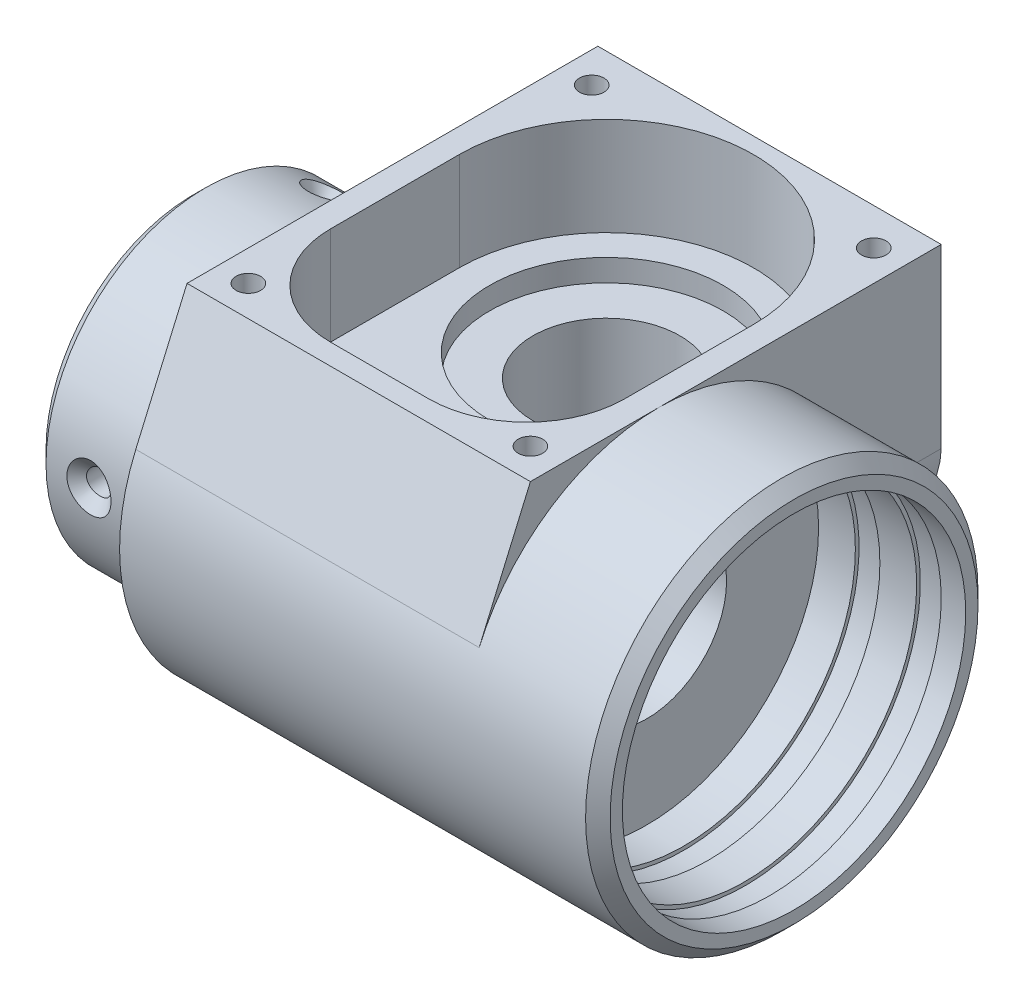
SolidWorks part; units mm, degrees
ref_plane "Plane1" through (0, 0, 0) normal (0, 0, 1) x (1, 0, 0)
ref_plane "Plane2" through (0, 0, 0) normal (0, 1, 0) x (1, 0, 0)
ref_plane "Plane3" through (0, 0, 0) normal (1, 0, 0) x (0, 0, -1)
sketch "Esquisse1" plane through (0, 0, 0) normal (0, 0, 1) x (1, 0, 0)
  line L0 (-37.8631, 0) -> (43.2337, 0) construction
  line L1 (-24, 0) -> (-24, 13)
  line L2 (-24, 13) -> (-14, 13)
  line L3 (-14, 13) -> (-14, 16)
  line L4 (-14, 16) -> (25, 16)
  line L5 (25, 16) -> (25, 0)
  line L6 (0, 0) -> (0, 32.7609) construction
  line L7 (25, 0) -> (-24, 0)
  dimension "D1" = 16
  dimension "D2" = 13
  dimension "D3" = 25
  dimension "D4" = 10
  dimension "D5" = 14
revolve "Base-Révolution" add sketch "Esquisse1" angle 360 about L0
chamfer "Chanfrein1" distance 1 angle 45
ref_plane "Plan4" through (0, 16, 0) normal (0, 1, 0) x (-1, 0, 0)
sketch "Esquisse2" plane through (0, 16, 0) normal (0, 1, 0) x (-1, 0, 0)
  line L0 (0, -19.7574) -> (0, 34.8803) construction
  line L1 (32.6576, 0) -> (-50.3214, 0) construction
  line L2 (-14, -23) -> (14, -23)
  line L3 (14, -23) -> (14, 10.5)
  line L4 (14, 10.5) -> (-14, 10.5)
  line L5 (-14, -23) -> (-14, 10.5)
  point P11 (0, -23)
  point P12 (0, 10.5)
  dimension "D1" = 14
  dimension "D2" = 23
  dimension "D3" = 10.5
extrude "Boss.-Extru.2" add sketch "Esquisse2" against normal blind 16
sketch "Esquisse3" plane through (14, 0, 0) normal (1, 0, 0) x (0, 0, -1)
  line L0 (-10.5, 16) -> (-14.6785, 6.3672)
  line L1 (-10.5, 16) -> (-10.5, 12.0727)
  arc A0 (0, 16) -> (-10.5, 12.0727) centre (0, 0) ccw construction
  arc A1 (-10.5, 12.0727) -> (-14.6785, 6.3672) centre (0, 0) ccw
extrude "Boss.-Extru.3" add sketch "Esquisse3" along normal up to surface (28 mm away)
ref_plane "Plan5" through (0, 0, -23) normal (0, 0, 1) x (1, 0, 0)
sketch "Esquisse7" plane through (0, 0, -23) normal (0, 0, 1) x (1, 0, 0)
  line L0 (0, 28.1619) -> (0, -32.0522) construction
  line L1 (14, 16) -> (-14, 16)
  line L2 (-14, 16) -> (-14, 0)
  line L3 (-14, 0) -> (-8.8013, -16)
  line L4 (-8.8013, -16) -> (8.8013, -16)
  line L5 (-14, 0) -> (-14, -17.7602) construction
  line L6 (14, 0) -> (8.8013, -16)
  line L7 (14, 16) -> (14, 0)
  point P13 (0, -16)
  point P15 (0, 16)
  dimension "D1" = 18
  dimension "D2" = 32
extrude "Boss.-Extru.5" add sketch "Esquisse7" along normal blind 23
sketch "Esquisse8" plane through (14, 0, 0) normal (1, 0, 0) x (0, 0, -1)
  line L0 (36.9905, 38.4387) -> (13.8182, -25.2269)
  line L1 (0, 0) -> (0, -26.9625) construction
  line L2 (13.8182, -25.2269) -> (43.0589, -25.2269)
  line L3 (36.9905, 38.4387) -> (59.2712, 38.4387)
  line L4 (59.2712, 38.4387) -> (43.0589, -25.2269)
  line L6 (9.5707, 16) -> (21.9836, 16) construction
  line L7 (23, 16) -> (0, 16) construction
  dimension "D1" = 20
extrude "Enlèv. mat.-Extru.2" cut sketch "Esquisse8" against normal through all
fillet "Congé1" radius 10
fillet "Congé2" radius 2
fillet "Congé4" radius 10
sketch "Esquisse9" plane through (0, 16, 0) normal (0, 1, 0) x (-1, 0, 0)
  line L0 (0, -25.3995) -> (0, 11.9181) construction
  line L1 (11.999, 0) -> (-10.981, 0) construction
  line L2 (37.8631, 0) -> (-43.2337, 0) construction
  line L3 (17.266, -9.7) -> (-15.3853, -9.7) construction
  line L4 (-12, -9.7) -> (-12, 0.8)
  line L5 (-4, 8.8) -> (4, 8.8)
  line L6 (12, -9.7) -> (12, 0.8)
  arc A0 (4, 8.8) -> (12, 0.8) centre (4, 0.8) cw
  arc A1 (-12, -9.7) -> (12, -9.7) centre (0, -9.7) ccw
  arc A2 (-4, 8.8) -> (-12, 0.8) centre (-4, 0.8) ccw
  point P19 (0, 8.8)
  dimension "D2" = 8.8
  dimension "D3" = 12
  dimension "D1" = 9.7
extrude "Enlèv. mat.-Extru.3" cut sketch "Esquisse9" against normal blind 8
sketch "Esquisse10" plane through (0, 16, 0) normal (0, 1, 0) x (-1, 0, 0)
  line L0 (-11.5, -30.8817) -> (-11.5, 24.0759) construction
  line L1 (0, -27.1203) -> (0, 13.4623) construction
  line L2 (0, -9.7) -> (10.2257, -9.7) construction
  line L3 (-19.7799, -20) -> (17.3323, -20) construction
  line L4 (-5.6983, 0) -> (11.5, 0) construction
  line L5 (23, 0) -> (24, 0) construction
  line L6 (-12.9073, 8) -> (17.3323, 8) construction
  line L7 (11.5, 19.1013) -> (11.5, -29.9868) construction
  circle A0 centre (-11.5, -20) radius 1
  circle A1 centre (11.5, -20) radius 1
  circle A2 centre (11.5, 8) radius 1
  circle A3 centre (-11.5, 8) radius 1
  dimension "D5" = 2
  dimension "D6" = 2
  dimension "D7" = 2
  dimension "D8" = 2
  dimension "D1" = 11.5
  dimension "D2" = 8
  dimension "D3" = 28
  dimension "D4" = 11.5
extrude "Enlèv. mat.-Extru.4" cut sketch "Esquisse10" against normal blind 7
sketch "Esquisse11" plane through (0, 8, 0) normal (0, 1, 0) x (-1, 0, 0)
  circle A0 centre (0, -9.7) radius 9.525
  dimension "D1" = 19.05
extrude "Enlèv. mat.-Extru.5" cut sketch "Esquisse11" against normal blind 1.8
sketch "Esquisse12" plane through (0, 6.2, 0) normal (0, 1, 0) x (-1, 0, 0)
  circle A0 centre (0, -9.7) radius 6
  dimension "D1" = 12
extrude "Enlèv. mat.-Extru.6" cut sketch "Esquisse12" against normal blind 19.7
sketch "Esquisse13" plane through (0, -13.5, 0) normal (0, 1, 0) x (-1, 0, 0)
  circle A0 centre (0, -9.7) radius 4.55
  dimension "D1" = 9.1
extrude "Enlèv. mat.-Extru.7" cut sketch "Esquisse13" against normal through all
sketch "Esquisse14" plane through (0, -16, 0) normal (0, -1, 0) x (1, 0, 0)
  circle A0 centre (0, -9.7) radius 5.5
  dimension "D1" = 11
extrude "Enlèv. mat.-Extru.8" cut sketch "Esquisse14" against normal blind 1.5
sketch "Esquisse16" plane through (25, 0, 0) normal (1, 0, 0) x (0, 0, -1)
  circle A0 centre (0, 0) radius 14
  dimension "D1" = 28
extrude "Enlèv. mat.-Extru.9" cut sketch "Esquisse16" against normal blind 12
sketch "Esquisse17" plane through (13, 0, 0) normal (1, 0, 0) x (0, 0, -1)
  circle A0 centre (0, 0) radius 6.5
  dimension "D1" = 13
extrude "Enlèv. mat.-Extru.10" cut sketch "Esquisse17" against normal blind 4
sketch "Esquisse18" plane through (-24, 0, 0) normal (-1, 0, 0) x (0, 0, 1)
  circle A0 centre (0, 0) radius 6.5
  dimension "D1" = 13
extrude "Enlèv. mat.-Extru.11" cut sketch "Esquisse18" against normal blind 18
sketch "Esquisse19" plane through (-6, 0, 0) normal (-1, 0, 0) x (0, 0, 1)
  circle A0 centre (0, 0) radius 5.35
  dimension "D1" = 10.7
extrude "Enlèv. mat.-Extru.12" cut sketch "Esquisse19" against normal through all
sketch "Esquisse20" plane through (13, 0, 0) normal (1, 0, 0) x (0, 0, -1)
  line L0 (0, 0) -> (0, -9.7306) construction
  circle A0 centre (-11, 0) radius 2
  dimension "D1" = 4
  dimension "D2" = 11
extrude "Enlèv. mat.-Extru.13" cut sketch "Esquisse20" against normal blind 11.7
sketch "Esquisse21" plane through (0, 0, 0) normal (0, 0, 1) x (1, 0, 0)
  line L0 (-25.3862, 0) -> (-9.6097, 0) construction
  line L1 (-23, 0) -> (-24, 0) construction
  line L2 (-19.5, 6.3672) -> (-19.5, -7.5256) construction
  line L3 (-14, 6.3672) -> (-14, -16) construction
  circle A0 centre (-19.5, 0) radius 1
  dimension "D2" = 2
  dimension "D1" = 5.5
extrude "Enlèv. mat.-Extru.14" cut sketch "Esquisse21" along normal blind 17.7
chamfer "Chanfrein3" distance 0.8 angle 45
pattern_circular "Répétition circulaire1" count 3 every 120
fillet "Congé5" radius 10
sketch "Esquisse22" plane through (0, 0, 0) normal (0, 0, 1) x (1, 0, 0)
  line L0 (21, 14.3) -> (23, 14.3)
  line L1 (21, 14.3) -> (21, 13.7069)
  line L2 (23, 11.851) -> (16, 11.851)
  line L3 (23, 11.851) -> (23, 14.3)
  line L4 (25, -15) -> (25, 15) construction
  line L5 (0.8663, 0) -> (23.6808, 0) construction
  line L6 (-6, 0) -> (-24, 0) construction
  line L7 (16, 14.3) -> (18, 14.3)
  line L8 (16, 14.3) -> (16, 11.851)
  line L10 (18, 13.7069) -> (18, 14.3)
  line L11 (21, 13.7069) -> (18, 13.7069)
  dimension "D1" = 2
  dimension "D3" = 14.3
  dimension "D4" = 3
  dimension "D5" = 2
revolve "Enlever de la matière-Révolution1" cut sketch "Esquisse22" angle 360 about L5
